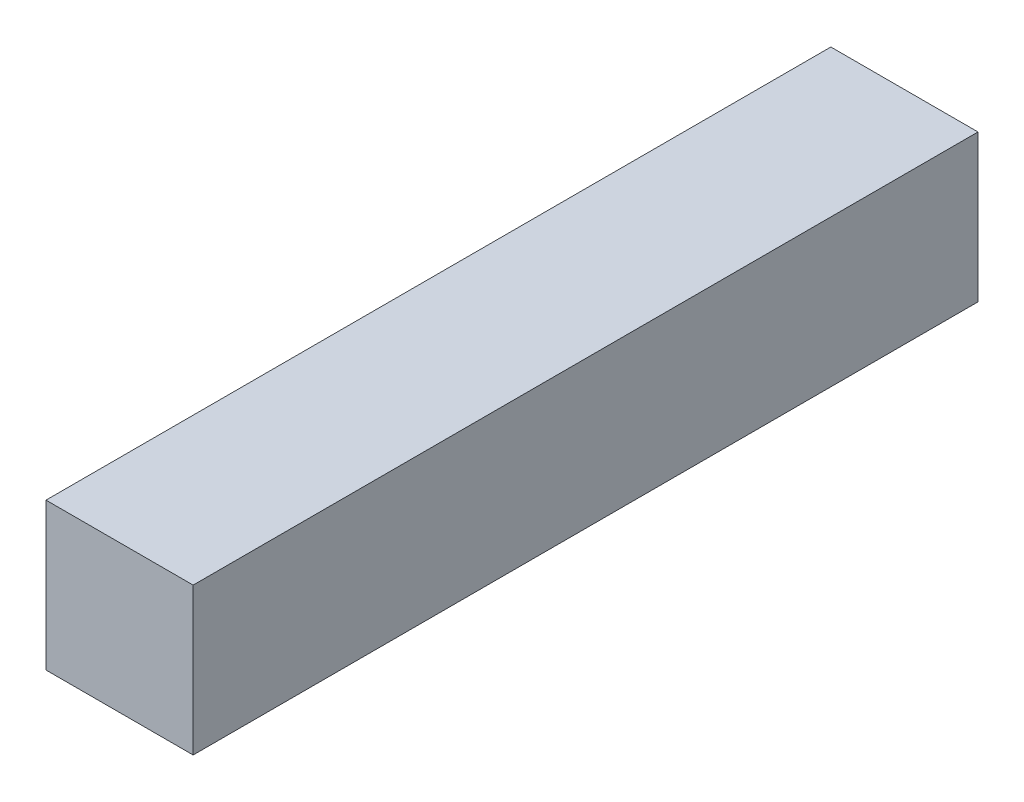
SolidWorks part; units mm, degrees
ref_plane "Front Plane" through (0, 0, 0) normal (0, 0, 1) x (1, 0, 0)
ref_plane "Top Plane" through (0, 0, 0) normal (0, 1, 0) x (1, 0, 0)
ref_plane "Right Plane" through (0, 0, 0) normal (1, 0, 0) x (0, 0, -1)
sketch "Sketch1" plane through (0, 0, 0) normal (0, 0, 1) x (1, 0, 0)
  line L1 (-2.3812, 2.3813) -> (2.3812, 2.3813)
  line L2 (-2.3812, 2.3813) -> (-2.3812, -2.3812)
  line L3 (-2.3812, -2.3812) -> (2.3813, -2.3812)
  line L4 (2.3812, 2.3813) -> (2.3813, -2.3812)
  line L5 (-2.3812, 2.3813) -> (2.3813, -2.3812) construction
  line L6 (-2.3812, -2.3812) -> (2.3812, 2.3813) construction
  point P0 (0, 0)
  dimension "D1" = 4.7625
  dimension "D2" = 4.7625
extrude "Boss-Extrude1" add sketch "Sketch1" along normal blind 25.4
